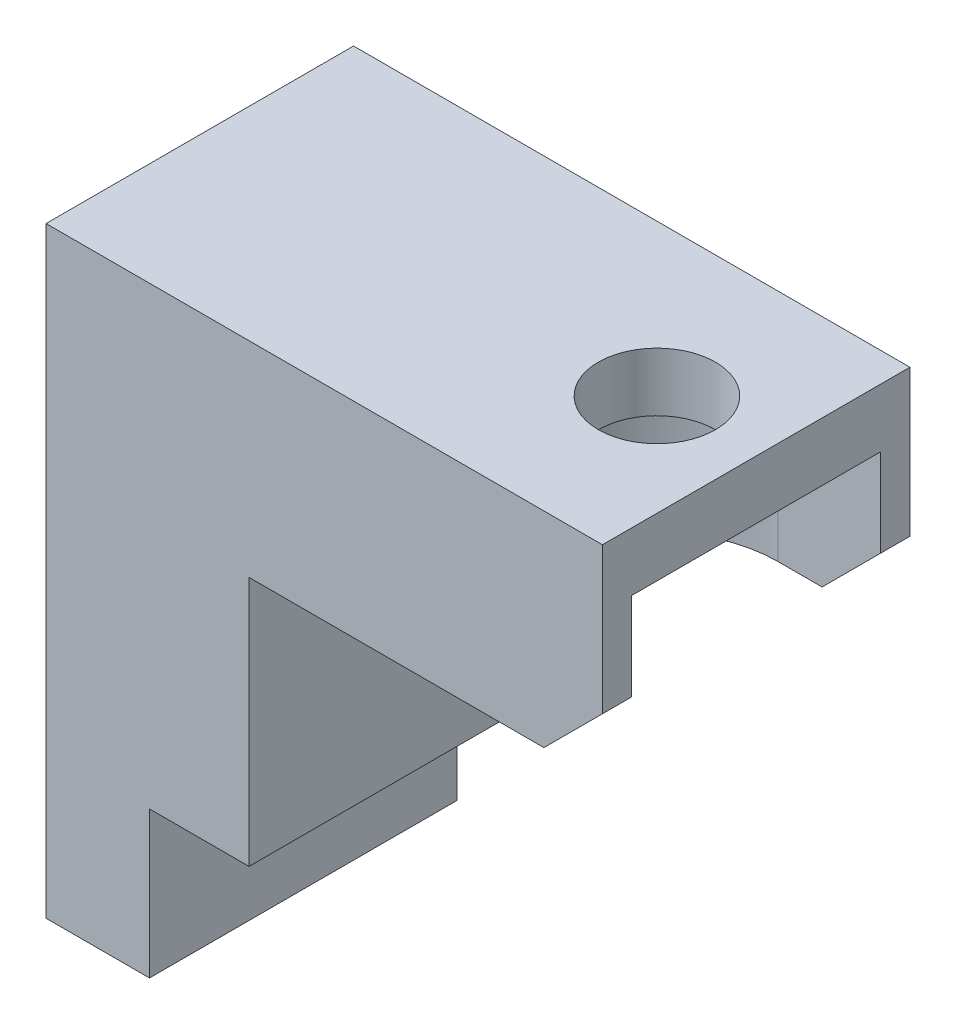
SolidWorks part; units mm, degrees
ref_plane "Face" through (0, 0, 0) normal (0, 0, 1) x (1, 0, 0)
ref_plane "Dessus" through (0, 0, 0) normal (0, 1, 0) x (1, 0, 0)
ref_plane "Droite" through (0, 0, 0) normal (1, 0, 0) x (0, 0, -1)
sketch "Esquisse1" plane through (0, 0, 0) normal (0, 0, 1) x (1, 0, 0)
  line L0 (-55.7193, 49) -> (-67.7876, 49)
  line L1 (-71.1876, 35.4526) -> (-71.1876, 30.4526)
  line L4 (-74.7193, 51) -> (-74.7193, 30.4526)
  line L6 (-67.7876, 35.4526) -> (-67.7876, 49)
  line L7 (-71.1876, 30.4526) -> (-74.7193, 30.4526)
  line L8 (-70.8023, 35.4526) -> (-72.3023, 35.4526) construction
  line L9 (-55.7193, 51) -> (-55.7193, 49)
  line L10 (-71.1876, 35.4526) -> (-67.7876, 35.4526)
  line L13 (-55.7193, 51) -> (-74.7193, 51)
  dimension "D1" = 15.4683
  dimension "D2" = 19
extrude "Extrusion1" add sketch "Esquisse1" along normal mid plane 10.5
sketch "Esquisse2" plane through (0, 49, 0) normal (0, -1, 0) x (1, 0, 0)
  line L0 (-55.7193, 5.25) -> (-55.7193, -5.25) construction
  line L1 (-55.7193, 5.25) -> (-69.8023, 5.25)
  line L2 (-55.7193, 5.25) -> (-55.7193, 4.25)
  line L3 (-55.7193, 4.25) -> (-59.2193, 4.25)
  line L4 (-69.8023, -5.25) -> (-69.8023, 5.25)
  line L6 (-55.7193, -5.25) -> (-69.8023, -5.25)
  line L7 (-55.7193, -5.25) -> (-55.7193, -4.25)
  line L8 (-55.7193, -4.25) -> (-59.2193, -4.25)
  arc A0 (-59.2193, -4.25) -> (-59.2193, 4.25) centre (-59.2193, 0) cw
  dimension "D1" = 1
  dimension "D2" = 1
  dimension "D3" = 3.5
extrude "Extrusion2" add sketch "Esquisse2" along normal blind 5
sketch "Esquisse3" plane through (0, 51, 0) normal (0, 1, 0) x (-1, 0, 0)
  circle A0 centre (59.1909, -0.0816) radius 2
  dimension "D1" = 4
extrude "Enlèv. mat.-Extru.1" cut sketch "Esquisse3" against normal up to surface (2 mm away)
chamfer "Chanfrein1" distance 2 angle 45 2 edges at (-55.7193, 44, 4.75) (-55.7193, 44, -4.75)
